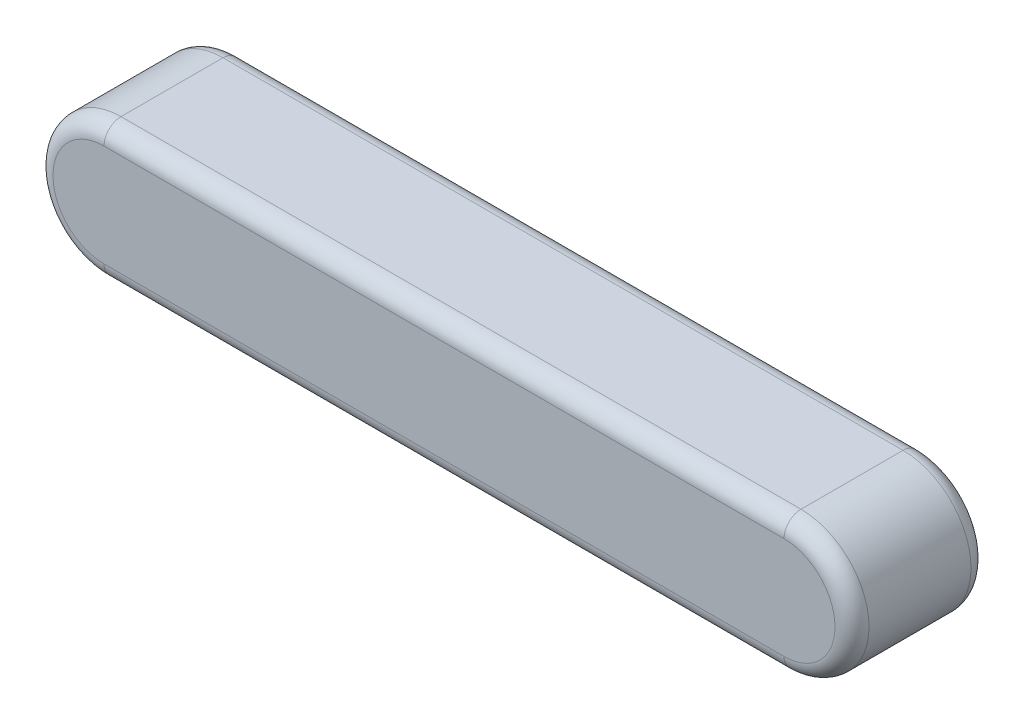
SolidWorks part; units mm, degrees
ref_plane "基准面1" through (0, 0, 0) normal (0, 0, 1) x (1, 0, 0)
ref_plane "基准面2" through (0, 0, 0) normal (0, 1, 0) x (1, 0, 0)
ref_plane "基准面3" through (0, 0, 0) normal (1, 0, 0) x (0, 0, -1)
sketch "尺寸草图" plane through (0, 0, 0) normal (0, 0, 1) x (1, 0, 0)
  line L0 (-6, 0) -> (6, 0) construction
  point P3 (-2, 0)
  point P4 (-0.25, 0)
  point P5 (0, 0)
  point P8 (-2, 0)
  point P11 (0, 0)
sketch "草图1" plane through (0, 0, 0) normal (0, 0, 1) x (1, 0, 0)
  line L0 (-28.0599, 0) -> (30.562, 0) construction
  line L1 (-5, 1) -> (5, 1)
  line L2 (-5, -1) -> (5, -1)
  line L3 (0, 2.9108) -> (0, -2.1805) construction
  arc A0 (-5, 1) -> (-5, -1) centre (-5, 0) ccw
  arc A1 (5, 1) -> (5, -1) centre (5, 0) cw
extrude "基体-拉伸" add sketch "草图1" along normal blind 2
fillet "圆角1" radius 0.25 8 edges at (6, 0, 2) (0, 1, 2) (-6, 0, 2) (0, 1, 0) (6, 0, 0) (0, -1, 0) (-6, 0, 0) (0, -1, 2)
equation "\"D3@草图1\" = \"L@尺寸草图\""
equation "\"D1@草图1\" = \"b@尺寸草图\" / 2"
equation "\"D1@圆角1\" = \"r@尺寸草图\""
equation "\"D1@基体-拉伸\" = \"h@尺寸草图\""
